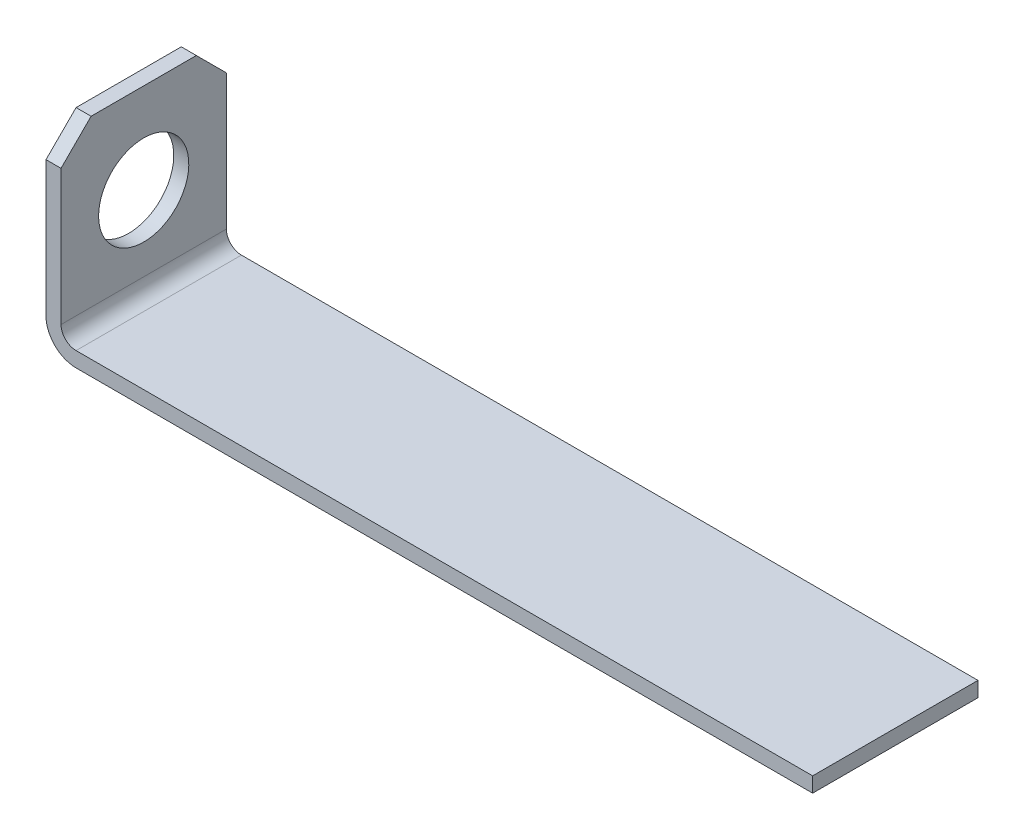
SolidWorks part; units mm, degrees
ref_plane "Face" through (0, 0, 0) normal (0, 0, 1) x (1, 0, 0)
ref_plane "Dessus" through (0, 0, 0) normal (0, 1, 0) x (1, 0, 0)
ref_plane "Droite" through (0, 0, 0) normal (1, 0, 0) x (0, 0, -1)
sketch "Esquisse1" plane through (0, 0, 0) normal (0, 0, 1) x (1, 0, 0)
  line L0 (0, 12) -> (0, 1)
  line L1 (1, 0) -> (50, 0)
  line L2 (1, -1) -> (50, -1)
  line L3 (-1, 12) -> (-1, 1)
  line L4 (50, 0) -> (50, -1)
  line L5 (-1, 12) -> (0, 12)
  arc A0 (1, 0) -> (0, 1) centre (1, 1) cw
  arc A1 (1, -1) -> (-1, 1) centre (1, 1) cw
  dimension "D1" = 1
  dimension "D2" = 12
  dimension "D3" = 50
  dimension "D5" = 90
  dimension "D4" = 1
extrude "Extrusion1" add sketch "Esquisse1" along normal blind 11
sketch "Esquisse2" plane through (0, 0, 0) normal (1, 0, 0) x (0, 0, -1)
  line L0 (-5.5, 12) -> (-5.5, -2.2318) construction
  line L1 (-11, 12) -> (0, 12) construction
  line L2 (-11, 0) -> (0, 0) construction
  circle A0 centre (-5.5, 6) radius 3
  dimension "D2" = 6
  dimension "D1" = 6
extrude "Enlèv. mat.-Extru.1" cut sketch "Esquisse2" against normal through all
chamfer "Chanfrein1" distance 2 angle 45 2 edges at (-0.5, 12, 0) (-0.5, 12, 11)
other "Bloquer***"
